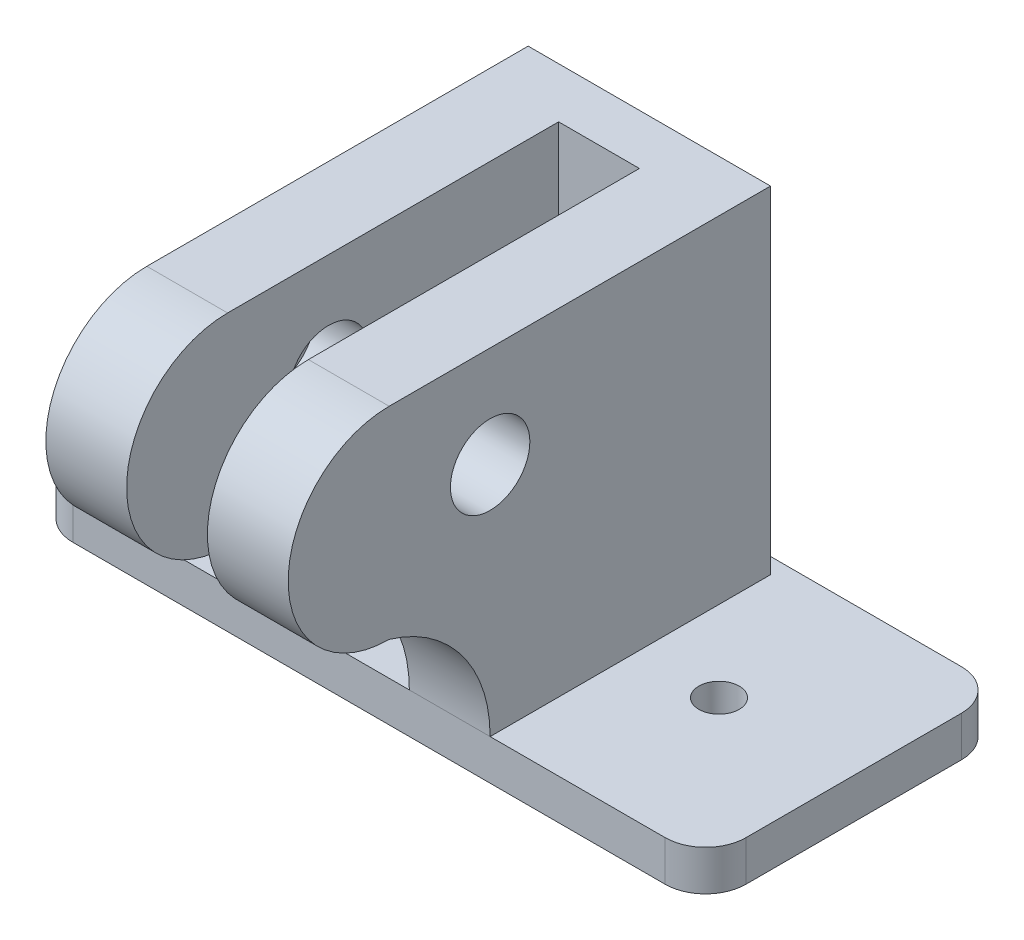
SolidWorks part; units mm, degrees
ref_plane "Front Plane" through (0, 0, 0) normal (0, 0, 1) x (1, 0, 0)
ref_plane "Top Plane" through (0, 0, 0) normal (0, 1, 0) x (1, 0, 0)
ref_plane "Right Plane" through (0, 0, 0) normal (1, 0, 0) x (0, 0, -1)
sketch "Sketch1" plane through (0, 0, 0) normal (0, 1, 0) x (1, 0, 0)
  line L1 (-25, 11) -> (25, 11)
  line L2 (-25, 11) -> (-25, -11)
  line L3 (-25, -11) -> (25, -11)
  line L4 (25, 11) -> (25, -11)
  line L5 (-25, 11) -> (25, -11) construction
  line L6 (-25, -11) -> (25, 11) construction
  point P0 (0, 0)
  dimension "D1" = 50
  dimension "D2" = 22
extrude "Boss-Extrude1" add sketch "Sketch1" along normal blind 3
sketch "Sketch2" plane through (0, 3, 0) normal (0, 1, 0) x (1, 0, 0)
  line L0 (0, 11) -> (0, -11) construction
  line L1 (25, 11) -> (-25, 11) construction
  line L2 (-25, -11) -> (25, -11) construction
  line L3 (25, 0) -> (-25, 0) construction
  line L4 (25, -11) -> (25, 11) construction
  line L5 (-25, 11) -> (-25, -11) construction
  line L6 (0, 6.0864) -> (3, 6.0864)
  line L7 (3, 6.0864) -> (3, -9.1482)
  line L9 (9, -9.1482) -> (9, 9.8249)
  line L10 (9, 9.8249) -> (-9, 9.8249)
  line L11 (-9, 9.8249) -> (-9, -9.1482)
  line L13 (-3, -9.1482) -> (-3, 6.0864)
  line L14 (-3, 6.0864) -> (0, 6.0864)
  line L15 (-9, -9.1482) -> (-9, -11)
  line L16 (-9, -11) -> (-3, -11)
  line L17 (-3, -11) -> (-3, -9.1482)
  line L18 (3, -9.1482) -> (3, -11)
  line L19 (3, -11) -> (9, -11)
  line L20 (9, -11) -> (9, -9.1482)
  dimension "D1" = 3
  dimension "D2" = 6
  dimension "D3" = 6
extrude "Boss-Extrude2" add sketch "Sketch2" along normal blind 25
sketch "Sketch6" plane through (9, 0, 0) normal (1, 0, 0) x (0, 0, -1)
  line L0 (-11, 28) -> (-18.5, 28)
  line L1 (-11, 3) -> (-11, 28)
  line L3 (-26, 13) -> (-11, 13) construction
  line L4 (-11, 28) -> (-11, 3) construction
  line L5 (-26, 20.5) -> (-11, 20.5) construction
  line L6 (-18.5, 28) -> (-18.5, 13) construction
  arc A0 (-18.5, 28) -> (-26, 20.5) centre (-18.5, 20.5) ccw
  arc A1 (-26, 20.5) -> (-18.5, 13) centre (-18.5, 20.5) ccw
  arc A2 (-18.5, 13) -> (-11, 3) centre (-21.546, 2.903) cw
  dimension "D2" = 15
  dimension "D3" = 7.5
sketch "Sketch7" plane through (0, 0, 11) normal (0, 0, 1) x (1, 0, 0)
  line L0 (-9, 28) -> (-3, 28)
  line L1 (-3, 28) -> (-3, 3)
  line L2 (-3, 3) -> (-9, 3)
  line L3 (-9, 3) -> (-9, 28)
  line L4 (3, 28) -> (3, 3)
  line L5 (3, 3) -> (9, 3)
  line L6 (9, 3) -> (9, 28)
  line L7 (9, 28) -> (3, 28)
extrude "Boss-Extrude18" add sketch "Sketch7" along normal blind 15
sketch "Sketch8" plane through (9, 0, 0) normal (1, 0, 0) x (0, 0, -1)
  line L0 (-11, 28) -> (-11, 3)
  line L1 (-11, 28) -> (-18.5, 28)
  line L3 (-26, 20.5) -> (-26, 3)
  line L4 (-26, 3) -> (-11, 3) construction
  line L5 (-26, 3) -> (-26, 28) construction
  line L6 (-26, 3) -> (-11, 3)
  line L7 (-26, 20.5) -> (-26, 28)
  line L8 (-26, 28) -> (-18.5, 28)
  arc A0 (-18.5, 28) -> (-18.5, 13) centre (-18.5, 20.5) ccw
  arc A4 (-11, 3) -> (-18.5, 13) centre (-21.4167, 3) ccw
extrude "Cut-Extrude6" cut sketch "Sketch8" against normal blind 18 contours A4 A0 M14 M13 | A0 M12 M13
sketch "Sketch9" plane through (9, 0, 0) normal (1, 0, 0) x (0, 0, -1)
  circle A0 centre (-11, 20.5) radius 2.95
  circle A1 centre (-11, 20.5) radius 1.45
  dimension "D1" = 5.9
  dimension "D2" = 2.9
extrude "Cut-Extrude7" cut sketch "Sketch9" against normal blind 18 contours A1
sketch "Sketch10" plane through (9, 0, 0) normal (1, 0, 0) x (0, 0, -1)
  circle A0 centre (-11, 20.5) radius 2.95
  dimension "D1" = 5.9
extrude "Cut-Extrude8" cut sketch "Sketch10" against normal blind 16
fillet "Fillet1" radius 3 4 edges at (-25, 1.5, -11) (-25, 1.5, 11) (25, 1.5, -11) (25, 1.5, 11)
sketch "Sketch11" plane through (0, 3, 0) normal (0, 1, 0) x (1, 0, 0)
  line L0 (-25, 0) -> (25, 0) construction
  line L1 (-25, 8) -> (-25, -8) construction
  line L2 (25, -8) -> (25, 8) construction
  line L3 (0, 11) -> (0, -11) construction
  line L4 (22, 11) -> (-22, 11) construction
  line L5 (-3, -11) -> (3, -11) construction
  circle A0 centre (-15, 0) radius 1.5
  circle A1 centre (15, 0) radius 1.5
  dimension "D1" = 3
  dimension "D2" = 10
extrude "Cut-Extrude9" cut sketch "Sketch11" against normal blind 16
